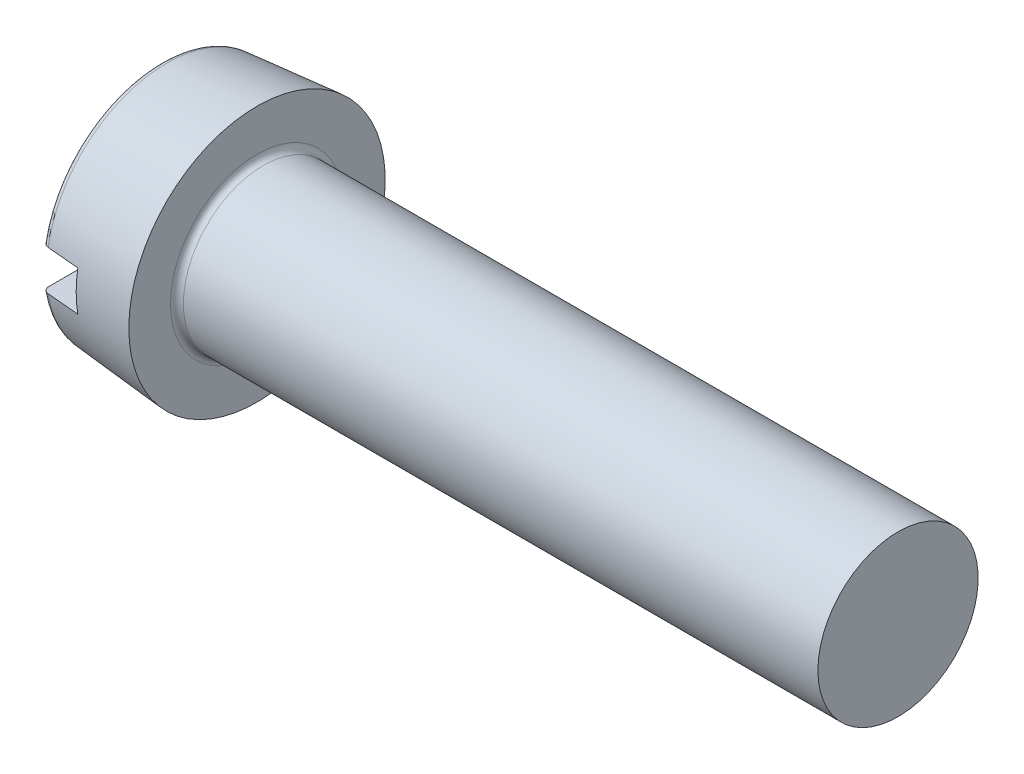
SolidWorks part; units mm, degrees
ref_plane "Front Plane" through (0, 0, 0) normal (0, 0, 1) x (1, 0, 0)
ref_plane "Top Plane" through (0, 0, 0) normal (0, 1, 0) x (1, 0, 0)
ref_plane "Right Plane" through (0, 0, 0) normal (1, 0, 0) x (0, 0, -1)
sketch "BodySke" plane through (0, 0, 0) normal (0, 0, 1) x (1, 0, 0)
  line L0 (0, 0) -> (154.7091, 0) construction
  line L1 (0, 0) -> (0, 7.4751)
  line L2 (0, 7.4751) -> (6, 8)
  line L3 (6, 8) -> (6, 5)
  line L4 (6, 5) -> (46, 5)
  line L5 (46, 5) -> (46, 0)
  line L6 (46, 0) -> (0, 0)
  line L7 (6, 0) -> (6, 8) construction
  line L8 (7.5, 0) -> (7.5, 8) construction
  point P12 (0, 4.172)
  dimension "Diameter" = 10
  dimension "Length" = 40
  dimension "Head_diameter" = 16
  dimension "Head_Height" = 6
  dimension "Head_side_angle" = 5
  dimension "Advance" = 1.5
  dimension "Thread_length" = 40
  dimension "Thread_minor" = 8.344
revolve "BaseBody" add sketch "BodySke" angle 360 about L0
fillet "Fillet1" radius 0.4 1 edges at (6, 0, 5)
fillet "Fillet2" radius 0.4 1 edges at (0, 0, 7.4751)
sketch "SlotSke" plane through (0, 0, 0) normal (-1, 0, 0) x (0, 0, 1)
  line L0 (8, -1.25) -> (-8, 1.25) construction
  line L1 (-8, 1.25) -> (8, 1.25)
  line L2 (-8, 1.25) -> (-8, -1.25)
  line L3 (-8, -1.25) -> (8, -1.25)
  line L4 (8, 1.25) -> (8, -1.25)
  dimension "D1" = 16
  dimension "Slot_width" = 2.5
extrude "Slot" cut sketch "SlotSke" against normal blind 2.4
sketch "ThdSchSke" plane through (0, 0, 0) normal (0, 0, 1) x (1, 0, 0)
  line L0 (0, 0) -> (51.3012, 0) construction
  line L1 (45.522, 5) -> (45.522, 5.9561)
  line L2 (45.522, 5.9561) -> (46.478, 5.9561)
  line L3 (46.478, 5.9561) -> (46.478, 5)
  line L4 (46.478, 5) -> (46, 4.172)
  line L5 (46, 4.172) -> (45.522, 5)
  line L6 (46, 5) -> (46, 0) construction
  line L7 (6, 5) -> (46, 5) construction
revolve "ThreadSchematic" [suppressed] cut sketch "ThdSchSke" angle 360 about L0
pattern_linear "ThdSchPat" [suppressed]
equation "\"Thread_length@ThreadCosmetic\" = \"Thread_length@BodySke\""
equation "\"Thread_minor@ThreadCosmetic\" = \"Thread_minor@BodySke\""
equation "\"D1@SlotSke\" = \"Head_diameter@BodySke\""
equation "\"Advance@ThdSchPat\" = \"Advance@BodySke\""
equation "\"Tooth_Num@ThdSchPat\" =  int( \"Thread_length@BodySke\" / \"Advance@BodySke\" )"
